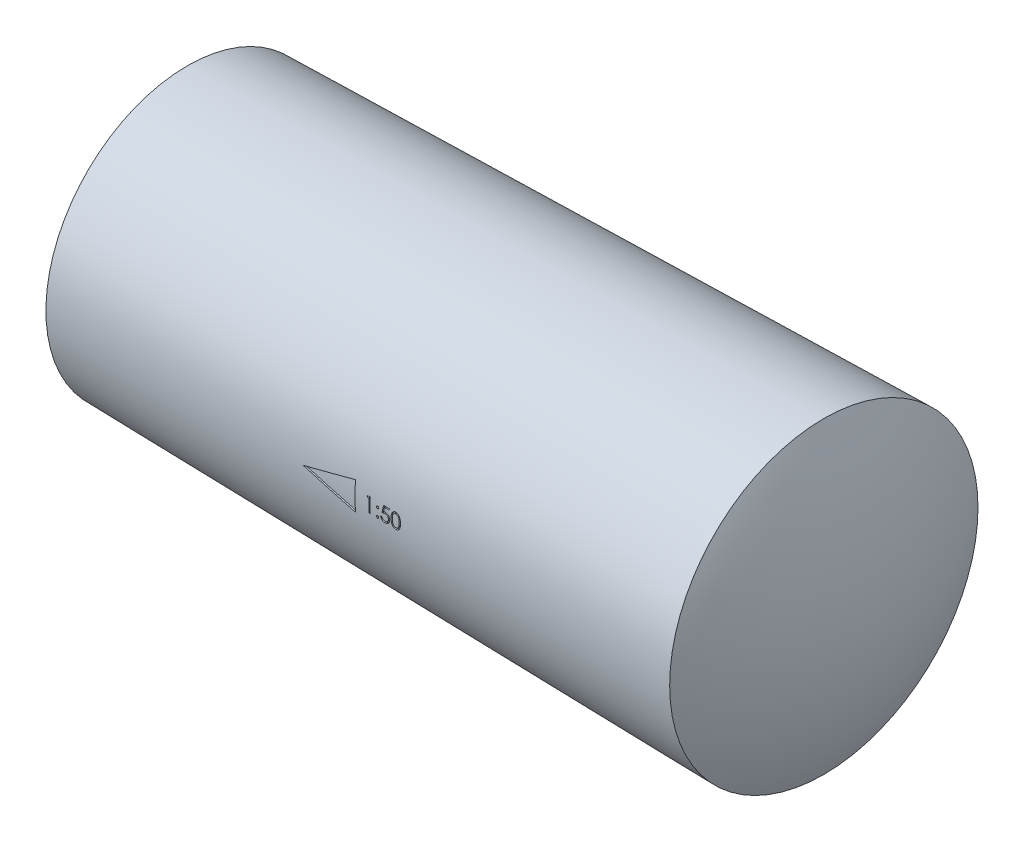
SolidWorks part; units mm, degrees
ref_plane "Front Plane" through (0, 0, 0) normal (0, 0, 1) x (1, 0, 0)
ref_plane "Top Plane" through (0, 0, 0) normal (0, 1, 0) x (1, 0, 0)
ref_plane "Right Plane" through (0, 0, 0) normal (1, 0, 0) x (0, 0, -1)
sketch "Sketch1" plane through (0, 0, 0) normal (1, 0, 0) x (0, 0, -1)
  circle A0 centre (0, 0) radius 10
  dimension "D1" = 20
extrude "Extrude1" add sketch "Sketch1" along normal mid plane 45
draft "Draft1" type of draft neutral plane draft angle 1.146 faces to draft 1 parameters "D1"=1.146
sketch "Sketch2" plane through (0, 0, 0) normal (0, 0, 1) x (1, 0, 0)
  line L0 (-22.5, 0) -> (-22.5, 10)
  line L1 (-22.5, 10) -> (-22.5, -10) construction
  line L2 (-22.5, 0) -> (-25, 0)
  line L3 (-25, 0) -> (-25, -10.45) construction
  line L4 (22.5, 0) -> (22.5, 10.9)
  line L5 (22.5, -10.9) -> (22.5, 10.9) construction
  line L6 (22.5, 0) -> (25, 0)
  line L7 (25, 0) -> (25, -10.45) construction
  line L8 (-22.5, -10) -> (22.5, -10.9) construction
  arc A0 (-25, 0) -> (-22.5, 10) centre (-3.75, 0) cw
  arc A1 (25, 0) -> (22.5, 10.9) centre (-0.0121, 0) ccw
  point P14 (0, -10.45)
revolve "Revolve1" add sketch "Sketch2" angle 360 about L2
sketch "Sketch5" plane through (0, 0, 0) normal (0, 0, 1) x (1, 0, 0)
  line L0 (0, 10.45) -> (0, -10.45) construction
  line L1 (22.5, 10.9) -> (-22.5, 10) construction
  line L2 (-22.5, -10) -> (22.5, -10.9) construction
ref_plane "Plane2" through (0, 0, 0) normal (-0.02, 0, 0.9998) x (0.9998, 0, 0.02)
sketch "Sketch6" plane through (0, 0, 0) normal (-0.02, 0, 0.9998) x (0.9998, 0, 0.02)
  line L0 (0, 0) -> (0, 1)
  line L1 (0, 10.45) -> (0, -10.45) construction
  line L2 (0, 1) -> (-3.7321, 0)
  line L3 (-3.7321, 0) -> (0, -1)
  line L4 (0, -1) -> (0, 0)
  line L5 (0, -0.5) -> (4, -0.5) construction
  text T0 "1:50" font "Century Gothic" height 1
  dimension "D1" = 2
  dimension "D2" = 30
  dimension "D3" = 4
wrap "Wrap2" sketch "Sketch6" wrap type deboss source sketch "Sketch6" thickness 0.1 parameters "D1"=0.1
equation "\"D2@Sketch2\" = \"D1@Sketch2\""
